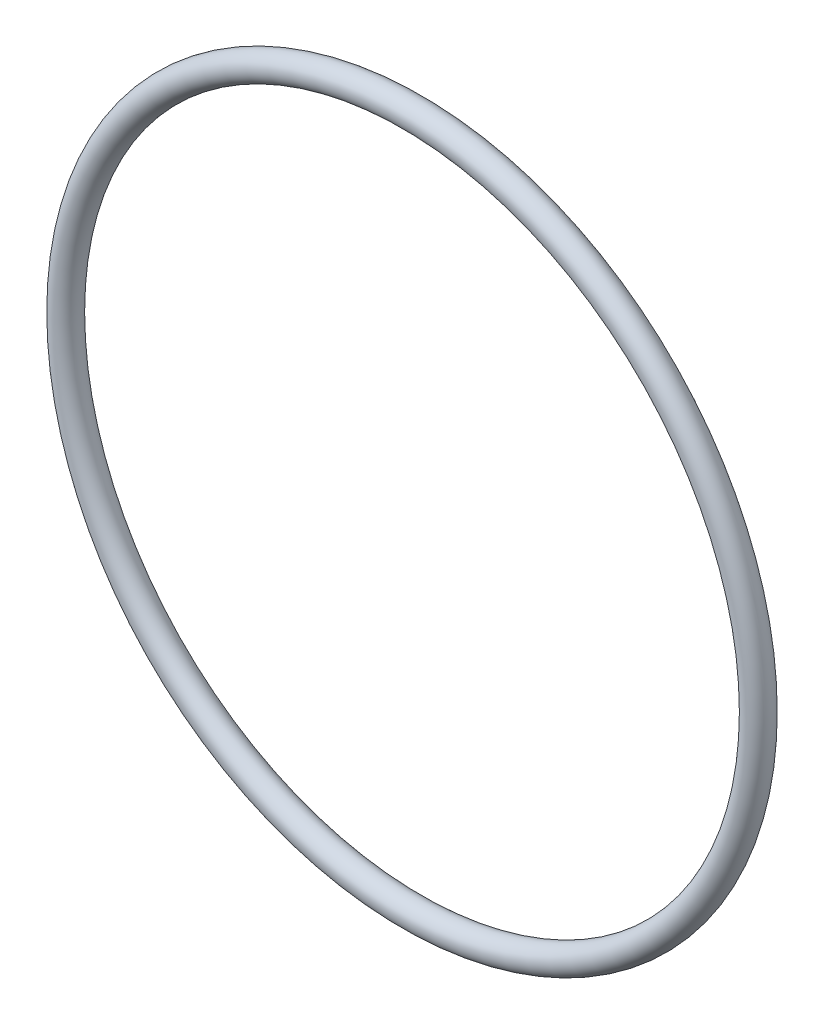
SolidWorks part; units mm, degrees
ref_plane "Front" through (0, 0, 0) normal (0, 0, 1) x (1, 0, 0)
ref_plane "Top" through (0, 0, 0) normal (0, 1, 0) x (1, 0, 0)
ref_plane "Right" through (0, 0, 0) normal (1, 0, 0) x (0, 0, -1)
sketch "Sketch1" plane through (0, 0, 0) normal (1, 0, 0) x (0, -1, 0)
  line L0 (0, -0.889) -> (0, 0.889) construction
  line L2 (-26.2496, 0) -> (26.2496, 0) construction
  line L3 (-22.0853, 0) -> (22.0853, 0) construction
  circle A0 centre (22.9743, 0) radius 0.889
  point P9 (22.0853, 0)
  point P10 (23.8633, 0)
  point P13 (22.9743, 0.889)
  point P14 (22.9743, -0.889)
  dimension "Width" = 1.778
  dimension "ID" = 44.1706
revolve "Revolve1" add sketch "Sketch1" angle 360 about L0
